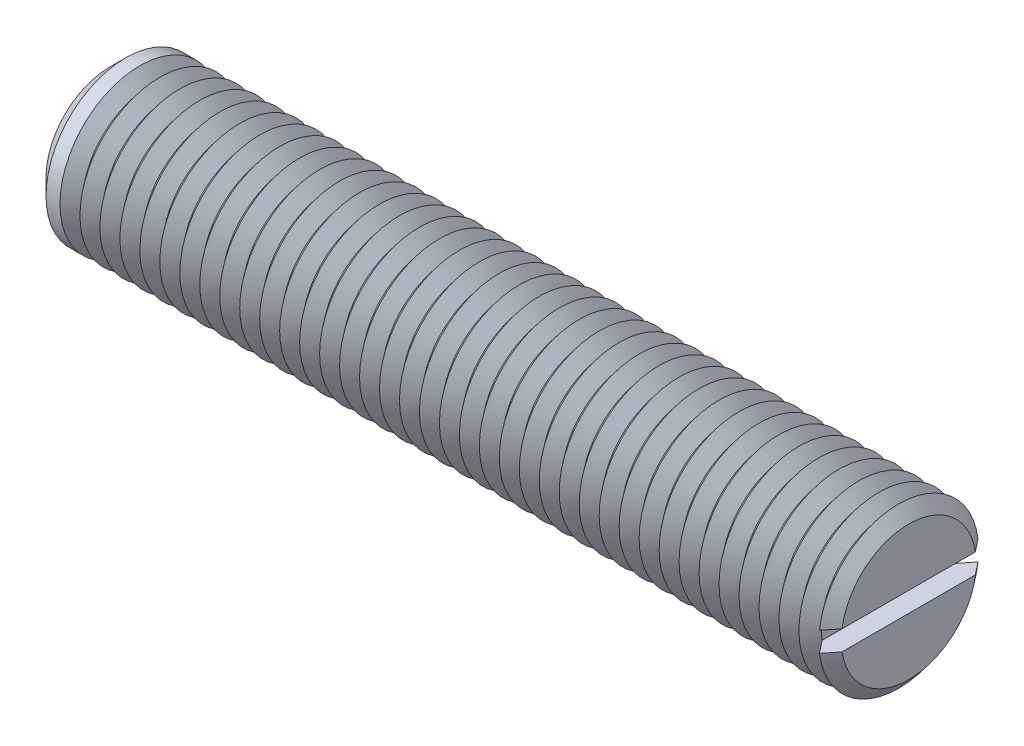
SolidWorks part; units mm, degrees
ref_plane "Front Plane" through (0, 0, 0) normal (0, 0, 1) x (1, 0, 0)
ref_plane "Top Plane" through (0, 0, 0) normal (0, 1, 0) x (1, 0, 0)
ref_plane "Right Plane" through (0, 0, 0) normal (1, 0, 0) x (0, 0, -1)
sketch "Sketch1" plane through (0, 0, 0) normal (1, 0, 0) x (0, 0, -1)
  circle A0 centre (0, 0) radius 8
  dimension "D1" = 16
extrude "Extrude1" add sketch "Sketch1" along normal mid plane 80
sketch "Sketch2" plane through (0, 0, 0) normal (0, 0, 1) x (1, 0, 0)
  line L0 (40, 1) -> (38, 1)
  line L1 (40, -8) -> (40, 8) construction
  line L2 (38, 1) -> (38, -1)
  line L3 (0, 0) -> (50000, 0) construction
  line L4 (40, -1) -> (38, -1)
  line L5 (40, -1) -> (40, 1)
  point P9 (38, 0)
  dimension "D1" = 2
extrude "Extrude2" cut sketch "Sketch2" against normal mid plane 24
chamfer "Chamfer1" distance 1.6 angle 45 1 edges at (-40, 0, -8)
sketch "Sketch3" plane through (0, 0, 0) normal (0, 0, 1) x (1, 0, 0)
  line L0 (0, 0) -> (30.9602, 0) construction
  line L1 (39, -8) -> (41, -8)
  line L2 (-38.4, -8) -> (40, -8) construction
  line L3 (41, -8) -> (40, -6.751)
  line L4 (40, -8) -> (40, -1) construction
  line L5 (40, -6.751) -> (39, -8)
  dimension "D1" = 2
  dimension "D2" = 1.6
revolve "Cut-Revolve1" cut sketch "Sketch3" angle 360 about L0
pattern_linear "LPattern1" count 39 spacing 2 along (-1, 0, 0) of "Cut-Revolve1"
equation "\"D2@Sketch3\" = \"D1@Sketch3\"*0.8"
